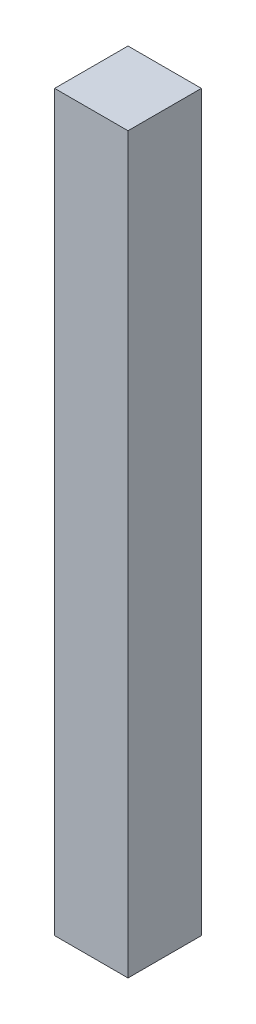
SolidWorks part; units mm, degrees
ref_plane "Front" through (0, 0, 0) normal (0, 0, 1) x (1, 0, 0)
ref_plane "Top" through (0, 0, 0) normal (0, 1, 0) x (1, 0, 0)
ref_plane "Right" through (0, 0, 0) normal (1, 0, 0) x (0, 0, -1)
sketch "Sketch2" plane through (0, 0, 0) normal (0, 1, 0) x (1, 0, 0)
  line L1 (0, 0) -> (10, 0)
  line L2 (0, 0) -> (0, 10)
  line L3 (0, 10) -> (10, 10)
  line L4 (10, 0) -> (10, 10)
  line L5 (5, 10) -> (5, 0) construction
  line L6 (0, 5) -> (10, 5) construction
  point P40 (5, 5)
  dimension "D1" = 10
  dimension "D2" = 10
extrude "Boss-Extrude1" add sketch "Sketch2" along normal blind 100
